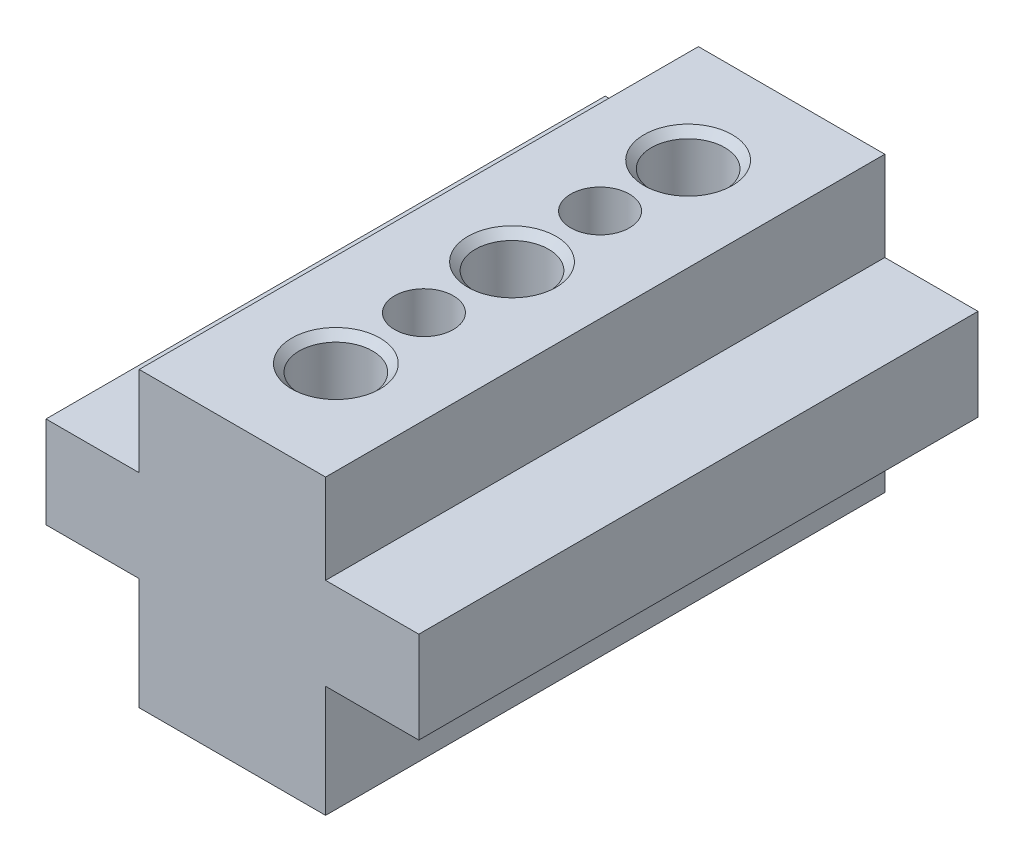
SolidWorks part; units mm, degrees
ref_plane "Front Plane" through (0, 0, 0) normal (0, 0, 1) x (1, 0, 0)
ref_plane "Top Plane" through (0, 0, 0) normal (0, 1, 0) x (1, 0, 0)
ref_plane "Right Plane" through (0, 0, 0) normal (1, 0, 0) x (0, 0, -1)
sketch "Sketch1" plane through (0, 0, 0) normal (0, 0, 1) x (1, 0, 0)
  line L0 (-6.35, -1.5621) -> (-3.175, -1.5621)
  line L1 (-3.175, -1.5621) -> (-3.175, -5.3721)
  line L2 (-3.175, -5.3721) -> (3.175, -5.3721)
  line L3 (3.175, -5.3721) -> (3.175, -1.5621)
  line L4 (3.175, -1.5621) -> (6.35, -1.5621)
  line L5 (6.35, -1.5621) -> (6.35, 1.5621)
  line L6 (6.35, 1.5621) -> (3.175, 1.5621)
  line L7 (3.175, 1.5621) -> (3.175, 4.6101)
  line L8 (3.175, 4.6101) -> (-3.175, 4.6101)
  line L9 (-3.175, 4.6101) -> (-3.175, 1.5621)
  line L10 (-3.175, 1.5621) -> (-6.35, 1.5621)
  line L11 (-6.35, 1.5621) -> (-6.35, -1.5621)
  line L12 (-6.35, 0) -> (6.35, 0) construction
  point P12 (6.35, 0)
  dimension "D1" = 6.35
  dimension "D2" = 12.7
  dimension "D3" = 3.1242
  dimension "D4" = 3.048
  dimension "D5" = 3.81
  dimension "D6" = 4.6101
extrude "Extrude1" add sketch "Sketch1" along normal mid plane 19.05
hole_wizard "M3x0.5 Tapped Hole1" positions "Sketch3" profile "Sketch2" tap size "M3x0.5" standard "ANSI Metric"
sketch "Sketch3" plane through (0, 4.6101, 0) normal (0, 1, 0) x (1, 0, 0)
  line L0 (0, 6) -> (0, 0) construction
  line L1 (0, 0) -> (0, -6) construction
  point P0 (0, 6)
  point P2 (0, 0)
  point P4 (0, -6)
  dimension "D1" = 6
sketch "Sketch2" plane through (0, 4.6101, -6) normal (1, 0, 0) x (0, 0, 1)
  line L0 (0, 0) -> (0, 7.2535)
  line L1 (0, 7.2535) -> (1.25, 6.5024)
  line L2 (1.25, 6.5024) -> (1.25, 0)
  line L5 (1.25, 0) -> (0, 0)
  line L10 (0, 7.2535) -> (-1.25, 6.5024) construction
  line L11 (0, -6.35) -> (0, 107.95) construction
  dimension "Tap Drill Dia." = 2.5
  dimension "Tap Drill Depth" = 6.5024
  dimension "Drill Angle" = 118
hole_wizard "Hole2" positions "Sketch5" profile "Sketch4" legacy
sketch "Sketch5" plane through (0, 4.6101, 0) normal (0, 1, 0) x (1, 0, 0)
  line L0 (0, 6) -> (0, 0) construction
  line L1 (0, 0) -> (0, -6) construction
  point P0 (0, 3)
  point P4 (0, -3)
sketch "Sketch4" plane through (0, 4.6101, -3) normal (1, 0, 0) x (0, 0, 1)
  line L0 (0, 0) -> (0, 4)
  line L1 (0, 4) -> (1, 4)
  line L2 (1, 4) -> (1, 0)
  line L3 (1, 0) -> (0, 0)
  line L4 (0, 110) -> (0, -10) construction
  dimension "Diameter" = 2
  dimension "Depth" = 4
chamfer "Chamfer1" distance 0.254 angle 45 3 edges at (0, 4.6101, -4.75) (0, 4.6101, 1.25) (0, 4.6101, 7.25)
